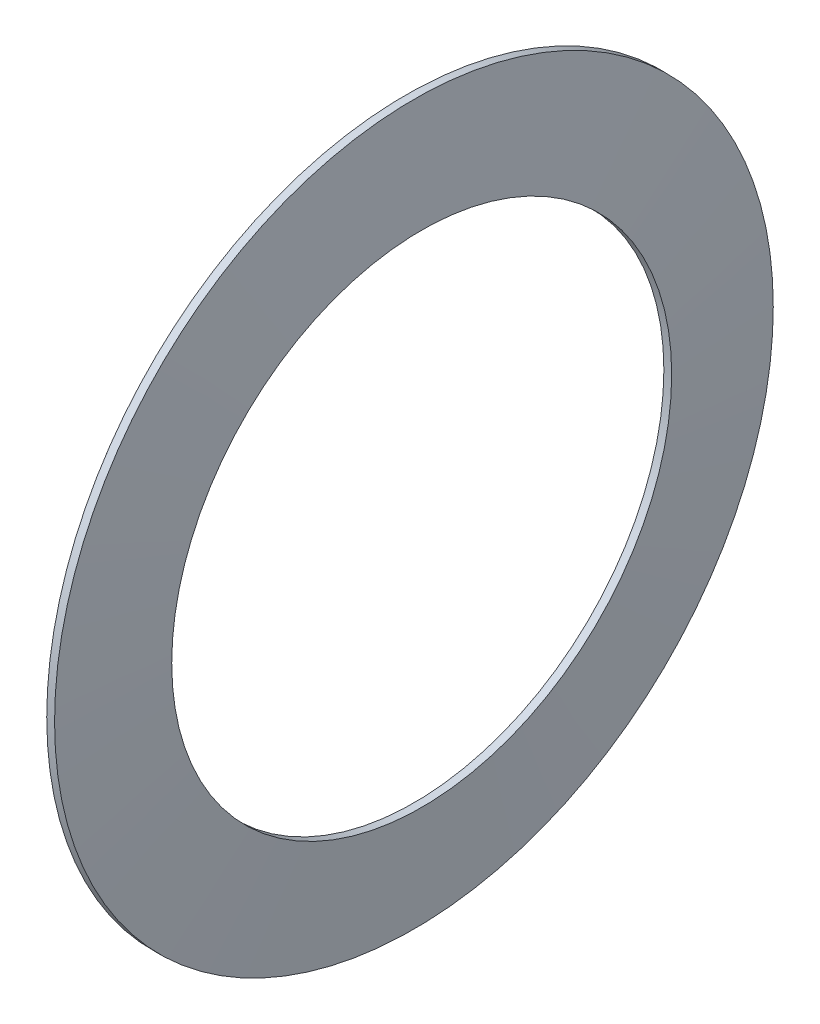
SolidWorks part; units mm, degrees
ref_plane "Face" through (0, 0, 0) normal (0, 0, 1) x (1, 0, 0)
ref_plane "Dessus" through (0, 0, 0) normal (0, 1, 0) x (1, 0, 0)
ref_plane "Droite" through (0, 0, 0) normal (1, 0, 0) x (0, 0, -1)
sketch "Esquisse1" plane through (0, 0, 0) normal (0, 0, 1) x (1, 0, 0)
  line L0 (0, 0) -> (18.6644, 0) construction
  line L1 (0, 23) -> (0.5013, 23)
  line L2 (0.5013, 23) -> (1, 16)
  line L3 (1, 16) -> (0.4987, 16)
  line L4 (0.4987, 16) -> (0, 23)
  line L5 (0, 0) -> (0, 36.9517) construction
  dimension "D1" = 46
  dimension "D2" = 0.5
  dimension "D3" = 1
  dimension "D4" = 32
revolve "Base-Révolution" add sketch "Esquisse1" angle 360 about L0
